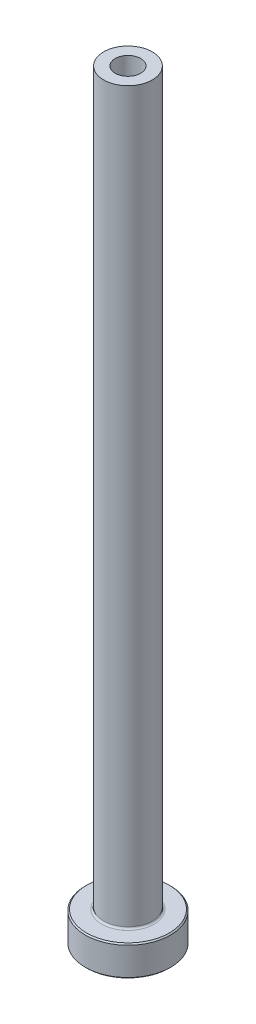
SolidWorks part; units mm, degrees
ref_plane "Front Plane" through (0, 0, 0) normal (0, 0, 1) x (1, 0, 0)
ref_plane "Top Plane" through (0, 0, 0) normal (0, 1, 0) x (1, 0, 0)
ref_plane "Right Plane" through (0, 0, 0) normal (1, 0, 0) x (0, 0, -1)
sketch "Sketch1" plane through (0, 0, 0) normal (0, 0, 1) x (1, 0, 0)
  line L0 (-2.1, 125) -> (-4, 125)
  line L1 (-4, 125) -> (-4, 5)
  line L2 (-4, 5) -> (-7, 5)
  line L3 (-7, 5) -> (-7, 0)
  line L4 (7.7, 0) -> (-7.7, 0) construction
  line L5 (-7, 0) -> (-2.35, 0)
  line L6 (-2.1, 80) -> (-2.1, 125)
  line L7 (0, 92.1877) -> (0, -15.5353) construction
  line L8 (0, -7.7) -> (0, 7.7) construction
  line L9 (-2.1, 80) -> (-2.35, 68)
  line L10 (-2.35, 68) -> (-2.35, 0)
  dimension "D1" = 0.25
  dimension "ID" = 4.2
  dimension "OD" = 8
  dimension "L" = 125
  dimension "H" = 14
  dimension "T" = 5
  dimension "N" = 45
  dimension "D2" = 12
revolve "Revolve1" add sketch "Sketch1" angle 360 about L7
fillet "Fillet1" radius 0.3 1 edges at (0, 5, 4)
chamfer "Chamfer1" distance 0.2 angle 45 2 edges at (0, 5, 7) (0, 0, 7)
chamfer "Chamfer3" distance 0.5 angle 45 1 edges at (0, 0, 2.35)
